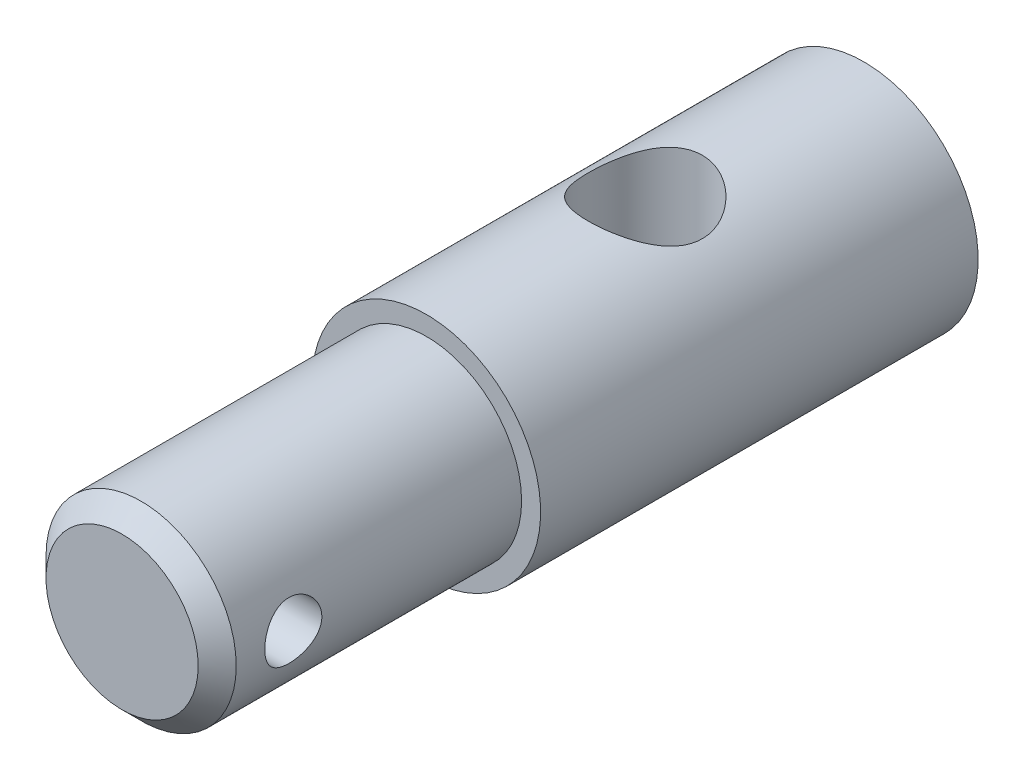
SolidWorks part; units mm, degrees
ref_plane "Спереди" through (0, 0, 0) normal (0, 0, 1) x (1, 0, 0)
ref_plane "Сверху" through (0, 0, 0) normal (0, 1, 0) x (1, 0, 0)
ref_plane "Справа" through (0, 0, 0) normal (1, 0, 0) x (0, 0, -1)
sketch "Эскиз2" plane through (0, 0, 0) normal (0, 0, 1) x (1, 0, 0)
  circle A0 centre (0, 0) radius 5
  dimension "D1" = 10
extrude "Бобышка-Вытянуть1" add sketch "Эскиз2" against normal blind 16
sketch "Эскиз3" plane through (0, 0, -16) normal (0, 0, -1) x (-1, 0, 0)
  circle A0 centre (0, 0) radius 6
  dimension "D1" = 12
extrude "Бобышка-Вытянуть2" add sketch "Эскиз3" along normal blind 23
sketch "Эскиз4" plane through (0, 0, 0) normal (0, 1, 0) x (1, 0, 0)
  line L0 (6, 39) -> (-6, 39) construction
  circle A0 centre (0, 27.5) radius 3
  dimension "D1" = 6
  dimension "D2" = 11.5
extrude "Вырез-Вытянуть1" cut sketch "Эскиз4" against normal mid plane 23
sketch "Эскиз5" plane through (0, 0, 0) normal (1, 0, 0) x (0, 0, -1)
  line L0 (16, 5) -> (16, -5) construction
  circle A0 centre (4, 0) radius 1.5
  dimension "D1" = 3
  dimension "D2" = 12
extrude "Вырез-Вытянуть2" cut sketch "Эскиз5" against normal mid plane 23
chamfer "Фаска1" distance 1 angle 45 1 edges at (5, 0, 0)
